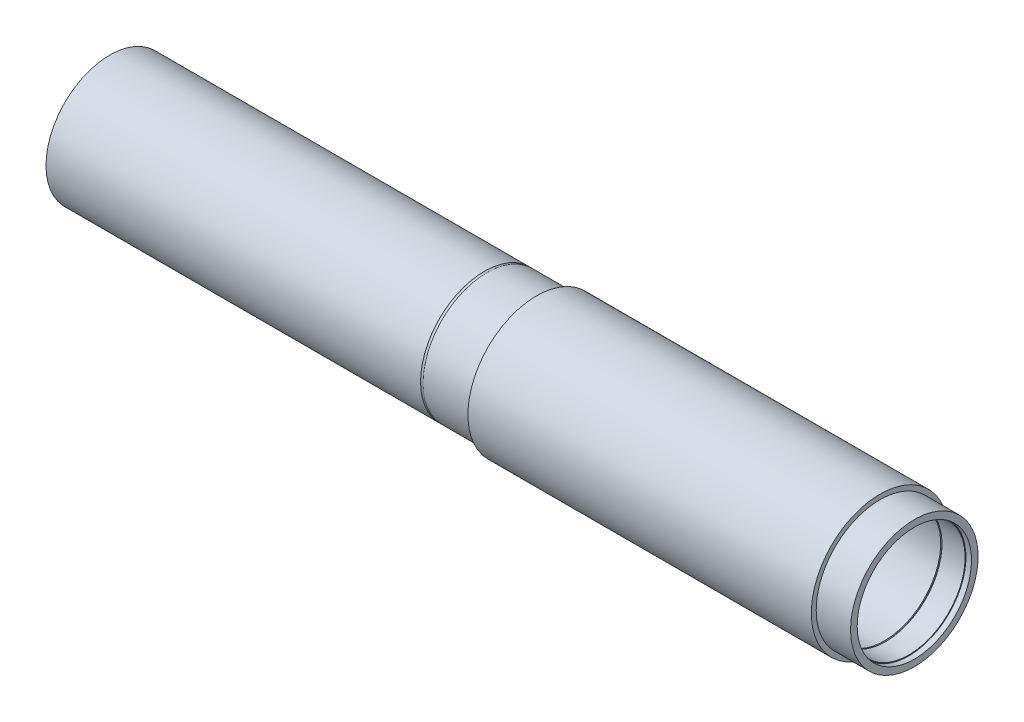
SolidWorks part; units mm, degrees
revolve "Base-Revolve" add sketch "Sketch1" angle 360 about L4
sketch "Sketch1" plane through (0, 0, 0) normal (0, 0, 1) x (1, 0, 0)
  line L0 (7.62, 73.0377) -> (37.2491, 73.0377)
  line L1 (1041.4, 73.9775) -> (1041.4, 82.5627)
  line L2 (1041.4, 82.5627) -> (1004.1509, 82.5627)
  line L3 (0, 82.5627) -> (0, 73.9775)
  line L4 (0, 0) -> (1041.4, 0) construction
  line L5 (0, -82.5627) -> (0, -73.9775) construction
  line L6 (1041.4, -82.5627) -> (488.0003, -82.5627) construction
  line L7 (1041.4, -73.0377) -> (1041.4, -82.5627) construction
  line L8 (7.366, -73.0377) -> (37.2491, -73.0377) construction
  line L9 (0, 73.9775) -> (7.112, 73.9775)
  line L10 (7.366, 73.7235) -> (7.366, 73.2917)
  line L11 (7.366, -73.9775) -> (7.366, -73.0377) construction
  line L12 (0, -73.9775) -> (7.366, -73.9775) construction
  line L13 (7.366, -73.7235) -> (7.366, -73.0377) construction
  line L14 (0, -73.9775) -> (7.112, -73.9775) construction
  line L15 (37.2491, 73.0377) -> (37.2491, 74.8538)
  line L16 (37.2491, 74.8538) -> (38.9509, 74.8538)
  line L17 (38.9509, 74.8538) -> (38.9509, 73.0377)
  line L18 (38.9509, 73.0377) -> (286.6136, 73.0377)
  line L19 (38.1, 74.8538) -> (38.1, 0) construction
  line L20 (288.3154, 73.0377) -> (753.0973, 73.0377)
  line L21 (286.6136, 74.8538) -> (286.6136, 73.0377)
  line L22 (288.3154, 74.8538) -> (286.6136, 74.8538)
  line L23 (288.3154, 73.0377) -> (288.3154, 74.8538)
  line L24 (287.4645, 74.8538) -> (287.4645, 0) construction
  line L25 (484.8197, 82.5627) -> (0, 82.5627)
  line L26 (38.9509, -74.8538) -> (38.9509, -73.0377) construction
  line L27 (37.2491, -74.8538) -> (38.9509, -74.8538) construction
  line L28 (37.2491, -73.0377) -> (37.2491, -74.8538) construction
  line L29 (38.9509, -73.0377) -> (286.6136, -73.0377) construction
  line L30 (288.3154, -73.0377) -> (288.3154, -74.8538) construction
  line L31 (288.3154, -74.8538) -> (286.6136, -74.8538) construction
  line L32 (286.6136, -74.8538) -> (286.6136, -73.0377) construction
  line L33 (288.3154, -73.0377) -> (1041.4, -73.0377) construction
  line L34 (484.8197, -82.5627) -> (0, -82.5627) construction
  line L35 (965.2, 82.1817) -> (965.2, 81.8007)
  line L36 (965.2, 81.8007) -> (965.9937, 80.4259)
  line L37 (965.9937, 80.4259) -> (966.7875, 81.8007)
  line L38 (966.7875, 81.8007) -> (966.7875, 79.7626) construction
  line L39 (968.375, 81.8007) -> (967.5812, 80.4259)
  line L40 (967.5812, 80.4259) -> (966.7875, 81.8007)
  line L41 (968.375, 81.8007) -> (968.375, 79.7626) construction
  line L42 (971.55, 81.8007) -> (970.7562, 80.4259)
  line L43 (970.7562, 80.4259) -> (969.9625, 81.8007)
  line L44 (969.1687, 80.4259) -> (969.9625, 81.8007)
  line L45 (968.375, 81.8007) -> (969.1687, 80.4259)
  line L46 (971.55, 81.8007) -> (971.55, 80.4259) construction
  line L47 (977.9, 81.8007) -> (977.1062, 80.4259)
  line L48 (977.1062, 80.4259) -> (976.3125, 81.8007)
  line L49 (975.5187, 80.4259) -> (976.3125, 81.8007)
  line L50 (974.725, 81.8007) -> (975.5187, 80.4259)
  line L51 (974.725, 81.8007) -> (973.9312, 80.4259)
  line L52 (973.9312, 80.4259) -> (973.1375, 81.8007)
  line L53 (972.3437, 80.4259) -> (973.1375, 81.8007)
  line L54 (971.55, 81.8007) -> (972.3437, 80.4259)
  line L55 (977.9, 81.8007) -> (977.9, 79.7626) construction
  line L56 (990.6, 81.8007) -> (989.8062, 80.4259)
  line L57 (989.8062, 80.4259) -> (989.0125, 81.8007)
  line L58 (988.2187, 80.4259) -> (989.0125, 81.8007)
  line L59 (987.425, 81.8007) -> (988.2187, 80.4259)
  line L60 (987.425, 81.8007) -> (986.6312, 80.4259)
  line L61 (986.6312, 80.4259) -> (985.8375, 81.8007)
  line L62 (985.0437, 80.4259) -> (985.8375, 81.8007)
  line L63 (984.25, 81.8007) -> (985.0437, 80.4259)
  line L64 (984.25, 81.8007) -> (983.4562, 80.4259)
  line L65 (983.4562, 80.4259) -> (982.6625, 81.8007)
  line L66 (981.8687, 80.4259) -> (982.6625, 81.8007)
  line L67 (981.075, 81.8007) -> (981.8687, 80.4259)
  line L68 (981.075, 81.8007) -> (980.2812, 80.4259)
  line L69 (980.2812, 80.4259) -> (979.4875, 81.8007)
  line L70 (978.6937, 80.4259) -> (979.4875, 81.8007)
  line L71 (977.9, 81.8007) -> (978.6937, 80.4259)
  line L72 (990.6, 81.8007) -> (990.6, 82.1817)
  line L73 (1002.4491, 82.5627) -> (990.981, 82.5627)
  line L74 (1002.4491, 74.8538) -> (1002.4491, 73.0377)
  line L75 (1004.1509, 73.0377) -> (1034.034, 73.0377)
  line L76 (753.0973, 74.8538) -> (753.0973, 73.0377)
  line L79 (1004.1509, 73.0377) -> (1004.1509, 74.8538)
  line L80 (1004.1509, 74.8538) -> (1002.4491, 74.8538)
  line L81 (775.97, 79.248) -> (775.97, 91.0012) construction
  line L82 (964.819, 82.5627) -> (587.121, 82.5627)
  line L83 (561.34, 82.1817) -> (561.34, 81.8007)
  line L84 (586.74, 82.1817) -> (586.74, 81.8007)
  line L85 (561.34, 81.8007) -> (562.1337, 80.4259)
  line L86 (562.1337, 80.4259) -> (562.9275, 81.8007)
  line L87 (562.9275, 81.8007) -> (562.9275, 79.7626) construction
  line L88 (564.515, 81.8007) -> (563.7212, 80.4259)
  line L89 (563.7212, 80.4259) -> (562.9275, 81.8007)
  line L90 (564.515, 81.8007) -> (564.515, 79.7626) construction
  line L91 (567.69, 81.8007) -> (566.8962, 80.4259)
  line L92 (566.8962, 80.4259) -> (566.1025, 81.8007)
  line L93 (565.3087, 80.4259) -> (566.1025, 81.8007)
  line L94 (564.515, 81.8007) -> (565.3087, 80.4259)
  line L95 (567.69, 81.8007) -> (567.69, 79.7626) construction
  line L96 (574.04, 81.8007) -> (573.2462, 80.4259)
  line L97 (573.2462, 80.4259) -> (572.4525, 81.8007)
  line L98 (571.6587, 80.4259) -> (572.4525, 81.8007)
  line L99 (570.865, 81.8007) -> (571.6587, 80.4259)
  line L100 (570.865, 81.8007) -> (570.0712, 80.4259)
  line L101 (570.0712, 80.4259) -> (569.2775, 81.8007)
  line L102 (568.4837, 80.4259) -> (569.2775, 81.8007)
  line L103 (567.69, 81.8007) -> (568.4837, 80.4259)
  line L104 (574.04, 81.8007) -> (574.04, 79.7626) construction
  line L105 (585.9462, 80.4259) -> (585.1525, 81.8007)
  line L106 (584.3587, 80.4259) -> (585.1525, 81.8007)
  line L107 (583.565, 81.8007) -> (584.3587, 80.4259)
  line L108 (583.565, 81.8007) -> (582.7712, 80.4259)
  line L109 (582.7712, 80.4259) -> (581.9775, 81.8007)
  line L110 (581.1837, 80.4259) -> (581.9775, 81.8007)
  line L111 (580.39, 81.8007) -> (581.1837, 80.4259)
  line L112 (580.39, 81.8007) -> (579.5962, 80.4259)
  line L113 (579.5962, 80.4259) -> (578.8025, 81.8007)
  line L114 (578.0087, 80.4259) -> (578.8025, 81.8007)
  line L115 (577.215, 81.8007) -> (578.0087, 80.4259)
  line L116 (577.215, 81.8007) -> (576.4212, 80.4259)
  line L117 (576.4212, 80.4259) -> (575.6275, 81.8007)
  line L118 (574.8337, 80.4259) -> (575.6275, 81.8007)
  line L119 (574.04, 81.8007) -> (574.8337, 80.4259)
  line L120 (585.9462, 80.4259) -> (586.74, 81.8007)
  line L121 (1004.1509, 82.5627) -> (1002.4491, 82.5627)
  line L123 (754.7991, 73.0377) -> (1002.4491, 73.0377)
  line L124 (754.7991, 74.8538) -> (753.0973, 74.8538)
  line L125 (560.959, 82.5627) -> (488.0003, 82.5627)
  line L126 (520.7, 0) -> (520.7, 176.784) construction
  line L127 (1034.034, 73.7235) -> (1034.034, 73.0377)
  line L128 (1041.4, 73.9775) -> (1034.288, 73.9775)
  line L130 (754.7991, 73.0377) -> (754.7991, 74.8538)
  arc A0 (7.112, 73.9775) -> (7.366, 73.7235) centre (7.112, 73.7235) cw
  arc A1 (7.112, -73.9775) -> (7.366, -73.7235) centre (7.112, -73.7235) ccw construction
  circle A2 centre (486.41, 83.2993) radius 1.7526 construction
  arc A3 (484.8197, 82.5627) -> (488.0003, 82.5627) centre (486.41, 83.2993) ccw
  arc A4 (484.8197, -82.5627) -> (488.0003, -82.5627) centre (486.41, -83.2993) cw construction
  arc A5 (964.819, 82.5627) -> (965.2, 82.1817) centre (964.819, 82.1817) cw
  arc A6 (990.6, 82.1817) -> (990.981, 82.5627) centre (990.981, 82.1817) cw
  arc A7 (561.34, 82.1817) -> (560.959, 82.5627) centre (560.959, 82.1817) ccw
  arc A8 (587.121, 82.5627) -> (586.74, 82.1817) centre (587.121, 82.1817) ccw
  arc A9 (1034.288, 73.9775) -> (1034.034, 73.7235) centre (1034.288, 73.7235) ccw
  arc A10 (7.366, 73.2917) -> (7.62, 73.0377) centre (7.62, 73.2917) ccw
  point P17 (7.366, 73.9775)
  point P35 (486.41, 81.5467)
  point P49 (486.41, -81.5467)
  point P101 (965.2, 82.5627)
  point P104 (990.6, 82.5627)
  point P160 (7.366, 73.0377)
  dimension "D6" = 0.254
  dimension "D14" = 1.7526
  dimension "D21" = 0.381
  dimension "D1" = 1041.4
  dimension "D2" = 0.9398
  dimension "D3" = 7.366
  dimension "D4" = 147.955
  dimension "D5" = 146.0754
  dimension "D7" = 8.5852
  dimension "D8" = 74.8538
  dimension "D9" = 1.7018
  dimension "D10" = 1.8161
  dimension "D11" = 38.1
  dimension "D12" = 287.4645
  dimension "D13" = 1.016
  dimension "D15" = 286.6009
  dimension "Oringdist" = 486.41
  dimension "D16" = 1.7018
  dimension "D19" = 25.4
  dimension "D20" = 50.8
ref_plane "Plane1" through (0, 0, 0) normal (0, 0, 1) x (1, 0, 0)
ref_plane "Plane2" through (0, 0, 0) normal (0, 1, 0) x (1, 0, 0)
ref_plane "Plane3" through (0, 0, 0) normal (1, 0, 0) x (0, 0, -1)
ref_plane "Plane4" through (1016.1905, 0, 82.5627) normal (0, 0, 1) x (0, 1, 0)
sketch "Sketch3" plane through (1016.1905, 0, 82.5627) normal (0, 0, 1) x (0, 1, 0)
  line L0 (0, 1016.1905) -> (0, -25.2095) construction
  line L1 (-82.5627, -25.2095) -> (82.5627, -25.2095) construction
  point P0 (0, 305.4985)
  dimension "D1" = 330.708
ref_plane "Plane5" through (710.692, 0, 0) normal (1, 0, 0) x (0, 0, -1)
sketch "Sketch4" plane through (710.692, 0, 0) normal (1, 0, 0) x (0, 0, -1)
  line L0 (-82.5627, 0) -> (-73.0377, 0) construction
  line L1 (-82.5627, 321.8171) -> (-82.5627, -321.8171) construction
  line L2 (-78.3971, 3.4544) -> (-72.956, 3.4544)
  line L3 (-78.3971, 3.4544) -> (-80.2767, 5.334)
  line L4 (-80.2767, 5.334) -> (-80.2767, 6.1595)
  line L5 (-80.2767, 6.1595) -> (-82.5627, 6.1595)
  line L6 (-78.3971, -3.4544) -> (-72.956, -3.4544) construction
  line L7 (-82.5627, 6.1595) -> (-82.5627, -6.1595) construction
  line L8 (-82.5627, 0) -> (-82.5627, 6.1595)
  line L9 (-80.2767, -6.1595) -> (-82.5627, -6.1595) construction
  line L10 (-80.2767, -5.334) -> (-80.2767, -6.1595) construction
  line L11 (-78.3971, -3.4544) -> (-80.2767, -5.334) construction
  line L13 (-82.5627, 0) -> (-73.0377, 0)
  circle A0 centre (0, 0) radius 73.0377 construction
  arc A1 (-72.956, 3.4544) -> (-72.956, -3.4544) centre (0, 0) ccw construction
  arc A2 (-73.0377, 0) -> (-72.956, 3.4544) centre (0, 0) cw
  dimension "D1" = 6.9088
  dimension "D2" = 12.319
  dimension "D3" = 2.286
  dimension "D4" = 45
  dimension "D5" = 1.8796
revolve "Cut-Revolve5" cut sketch "Sketch4" angle 360 about L0
ref_plane "Plane8" through (996.95, 0, 0) normal (1, 0, 0) x (0, 0, -1)
sketch "Sketch6" plane through (996.95, 0, 0) normal (1, 0, 0) x (0, 0, -1)
  circle A0 centre (0, 0) radius 82.5627
  circle A1 centre (0, 0) radius 82.5627 construction
  circle A2 centre (0, 0) radius 88.9
  dimension "D1" = 177.8
extrude "AirBladder1" add sketch "Sketch6" against normal blind 444.5 separate body
